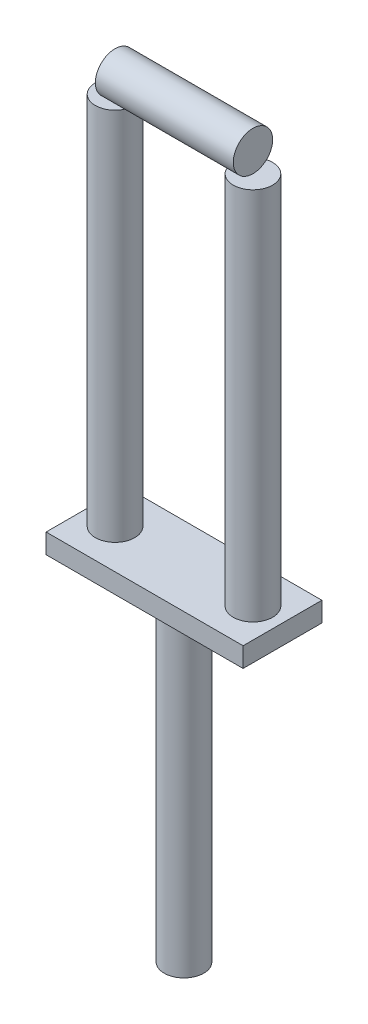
SolidWorks part; units mm, degrees
ref_plane "Plan de face" through (0, 0, 0) normal (0, 0, 1) x (1, 0, 0)
ref_plane "Plan de dessus" through (0, 0, 0) normal (0, 1, 0) x (1, 0, 0)
ref_plane "Plan de droite" through (0, 0, 0) normal (1, 0, 0) x (0, 0, -1)
sketch "Esquisse1" plane through (0, 0, 0) normal (0, 1, 0) x (1, 0, 0)
  line L0 (-25, 0) -> (25, 0)
  dimension "D1" = 50
other "Elément mécano-soudé1"
ref_plane "Plan1" through (-25, 0, 0) normal (1, 0, 0) x (0, 0, -1)
sketch "Esquisse11" plane through (-25, 2.5, 0) normal (1, 0, 0) x (0, 0, -1)
  line L0 (0, 2.5) -> (0, -2.5) construction
  line L1 (-10, 2.5) -> (10, 2.5)
  line L2 (-10, 2.5) -> (-10, -2.5)
  line L3 (-10, -2.5) -> (10, -2.5)
  line L4 (10, 2.5) -> (10, -2.5)
  line L5 (-10, 0) -> (10, 0) construction
  point P8 (0, 0)
  dimension "D1" = 5
  dimension "D2" = 20
sketch "Esquisse12" plane through (0, 0, 0) normal (0, 0, 1) x (1, 0, 0)
  line L0 (0, 0) -> (0, -82)
  line L1 (17.5, 5) -> (17.5, 100)
  line L2 (25, 5) -> (-25, 5) construction
  line L3 (17.5, 100) -> (-17.5, 100) construction
  line L4 (-17.5, 100) -> (-17.5, 5)
  line L5 (0, 0) -> (0, 100) construction
  dimension "D1" = 82
  dimension "D2" = 95
  dimension "D3" = 35
other "Elément mécano-soudé2"
ref_plane "Plan2" through (0, 0, 0) normal (0, -1, 0) x (1, 0, 0)
sketch "Esquisse13" plane through (0, 0, 0) normal (0, -1, 0) x (1, 0, 0)
  line L0 (0, 5) -> (0, -5) construction
  line L1 (-5, 0) -> (5, 0) construction
  circle A0 centre (0, 0) radius 5
  point P7 (0, 0)
  dimension "D1" = 10
sketch "Esquisse14" plane through (0, 100, 0) normal (0, 1, 0) x (-1, 0, 0)
  line L0 (-17.5, 0) -> (17.5, 0)
other "Elément mécano-soudé3"
ref_plane "Plan3" through (17.5, 100, 0) normal (-1, 0, 0) x (0, 0, 1)
sketch "Esquisse15" plane through (17.5, 105, 0) normal (-1, 0, 0) x (0, 0, 1)
  line L0 (0, 5) -> (0, -5) construction
  line L1 (-5, 0) -> (5, 0) construction
  circle A0 centre (0, 0) radius 5
  point P7 (0, 0)
  dimension "D1" = 10
